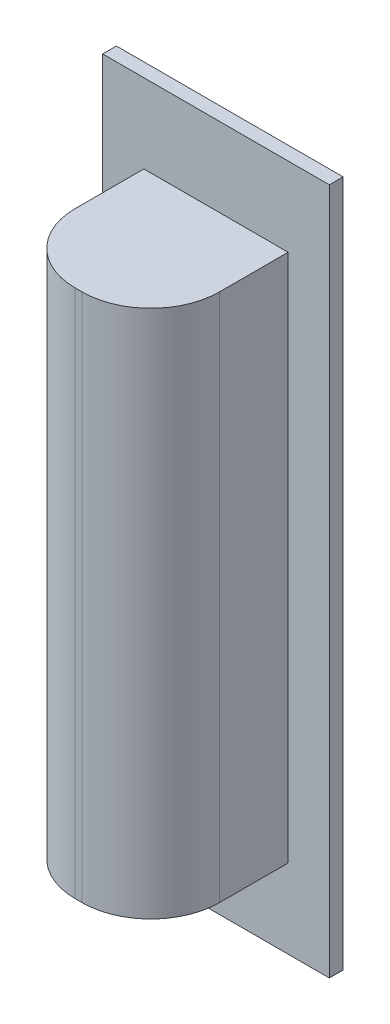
SolidWorks part; units mm, degrees
ref_plane "Alzado" through (0, 0, 0) normal (0, 0, 1) x (1, 0, 0)
ref_plane "Planta" through (0, 0, 0) normal (0, 1, 0) x (1, 0, 0)
ref_plane "Vista lateral" through (0, 0, 0) normal (1, 0, 0) x (0, 0, -1)
sketch "Sketch1" plane through (0, 0, 0) normal (0, 0, 1) x (1, 0, 0)
  line L1 (-16.5, 50) -> (16.5, 50)
  line L2 (-16.5, 50) -> (-16.5, -50)
  line L3 (-16.5, -50) -> (16.5, -50)
  line L4 (16.5, 50) -> (16.5, -50)
  line L5 (-16.5, 50) -> (16.5, -50) construction
  line L6 (-16.5, -50) -> (16.5, 50) construction
  point P0 (0, 0)
  dimension "D1" = 100
  dimension "D2" = 33
extrude "Boss-Extrude1" add sketch "Sketch1" along normal blind 2
sketch "Sketch4" plane through (0, 0, 2) normal (0, 0, 1) x (1, 0, 0)
  line L1 (-10.5, -38.5) -> (10.5, -38.5)
  line L2 (-10.5, -38.5) -> (-10.5, 38.5)
  line L3 (-10.5, 38.5) -> (10.5, 38.5)
  line L4 (10.5, -38.5) -> (10.5, 38.5)
  line L5 (-10.5, -38.5) -> (10.5, 38.5) construction
  line L6 (-10.5, 38.5) -> (10.5, -38.5) construction
  point P0 (0, 0)
  dimension "D1" = 77
  dimension "D2" = 21
extrude "Boss-Extrude4" add sketch "Sketch4" along normal blind 20
fillet "Fillet2" radius 10 2 edges at (-10.5, 0, 22) (10.5, 0, 22)
sketch "Sketch5" plane through (0, 0, 0) normal (0, 0, -1) x (-1, 0, 0)
  line L0 (16.5, -50) -> (-16.5, -50) construction
  line L1 (5.25, -4.59) -> (11.25, -4.59)
  line L2 (5.25, -4.59) -> (5.25, -10.59)
  line L3 (5.25, -10.59) -> (11.25, -10.59)
  line L4 (11.25, -4.59) -> (11.25, -10.59)
  line L5 (5.25, -4.59) -> (11.25, -10.59) construction
  line L6 (5.25, -10.59) -> (11.25, -4.59) construction
  line L7 (16.5, 50) -> (16.5, -50) construction
  point P0 (8.25, -7.59)
  dimension "D1" = 42.41
  dimension "D2" = 6
  dimension "D3" = 6
  dimension "D4" = 8.25
extrude "Boss-Extrude5" add sketch "Sketch5" along normal blind 12
sketch "Sketch6" plane through (-11.25, 0, 0) normal (-1, 0, 0) x (0, 0, 1)
  line L0 (-12, -10.59) -> (-12, -4.59) construction
  circle A0 centre (-8.7235, -7.59) radius 3.125
  point P2 (0, 0)
  point P3 (-8.7235, -7.59)
  point P5 (-12, -7.59)
  dimension "D1" = 6.25
extrude "Boss-Extrude6" add sketch "Sketch6" along normal blind 8.55
